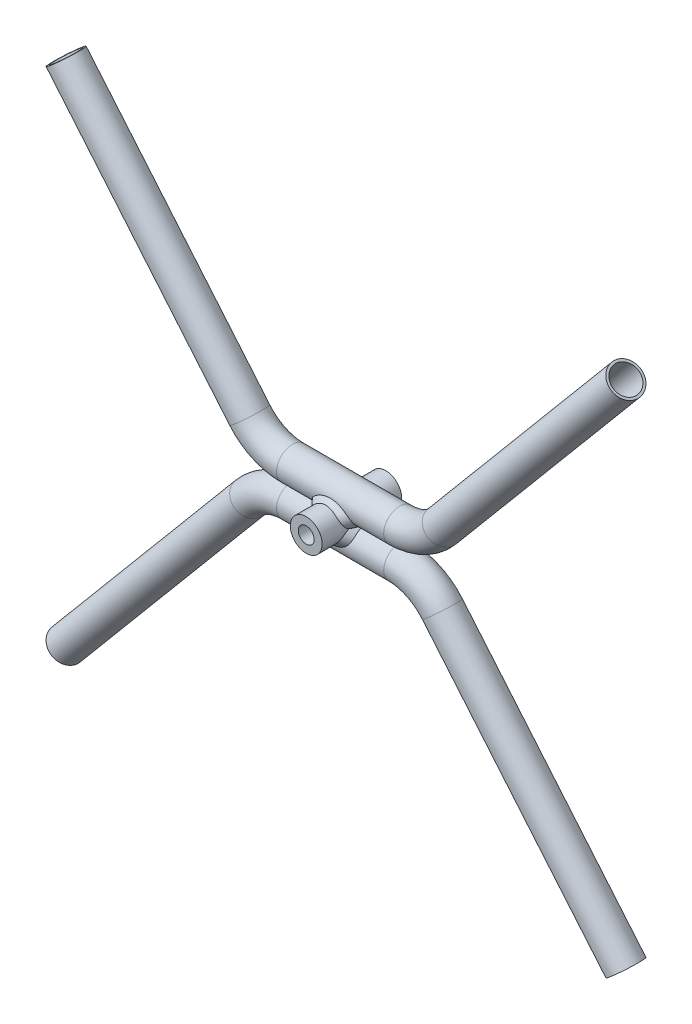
SolidWorks part; units mm, degrees
other "Detailelement1"
other "Detailelement4"
other "Detailelement5"
ref_plane "Ebene vorne" through (0, 0, 0) normal (0, 0, 1) x (1, 0, 0)
ref_plane "Ebene oben" through (0, 0, 0) normal (0, 1, 0) x (1, 0, 0)
ref_plane "Ebene rechts" through (0, 0, 0) normal (1, 0, 0) x (0, 0, -1)
sketch "Skizze1" plane through (0, 0, 0) normal (0, 0, 1) x (1, 0, 0)
  line L1 (0, 0) -> (-33.6792, 0)
  line L2 (-60.4908, -12.5024) -> (-175.8649, -150)
  line L3 (0, 34.0258) -> (0, -80.3148) construction
  arc A0 (-33.6792, 0) -> (-60.4908, -12.5024) centre (-33.6792, -35) ccw
  point P10 (-50, 0)
  point P13 (50, 0)
  dimension "D6" = 35
  dimension "D1" = 50
  dimension "D2" = 50
  dimension "D4" = 150
sketch "Skizze2" plane through (0, 0, 0) normal (1, 0, 0) x (0, 0, -1)
  circle A0 centre (0, 0) radius 10
  circle A1 centre (0, 0) radius 8.5
  dimension "D1" = 20
  dimension "D2" = 1.5
sweep "Austragung3" add profiles "Skizze2" path "Skizze1"
mirror "Spiegeln2" about plane through (0, 0, 0) normal (1, 0, 0) of "Austragung3"
ref_plane "Ebene1" through (0, 10, 0) normal (0, 1, 0) x (-1, 0, 0)
mirror "Spiegeln3" about plane through (0, 10, 0) normal (0, 1, 0)
other "Kehlnaht1" parameters "D10"=6, "D11"=40, "D12"=20, "D13"=3, "D14"=3
sketch "Skizze3" plane through (0, 0, 0) normal (0, 0, 1) x (1, 0, 0)
  line L0 (0, 56.6448) -> (0, -45.663) construction
  line L1 (-33.6792, 10) -> (33.6792, 10) construction
  circle A0 centre (0, 10) radius 10
  dimension "D1" = 20
extrude "Linear austragen1" cut sketch "Skizze3" against normal mid plane 50
inserted part "S_BUCHSE"
move or copy body "Körper-Verschieben/Kopieren2" placed by mates yes
other "Abstand1" parameters "D1"=25
other "<S_BUCHSE>-<Rotation1>"
other "Kehlnaht4" parameters "D10"=6, "D11"=3, "D12"=0, "D13"=3, "D14"=0
other "Kehlnaht5" parameters "D10"=6, "D11"=3, "D12"=0, "D13"=3, "D14"=0
